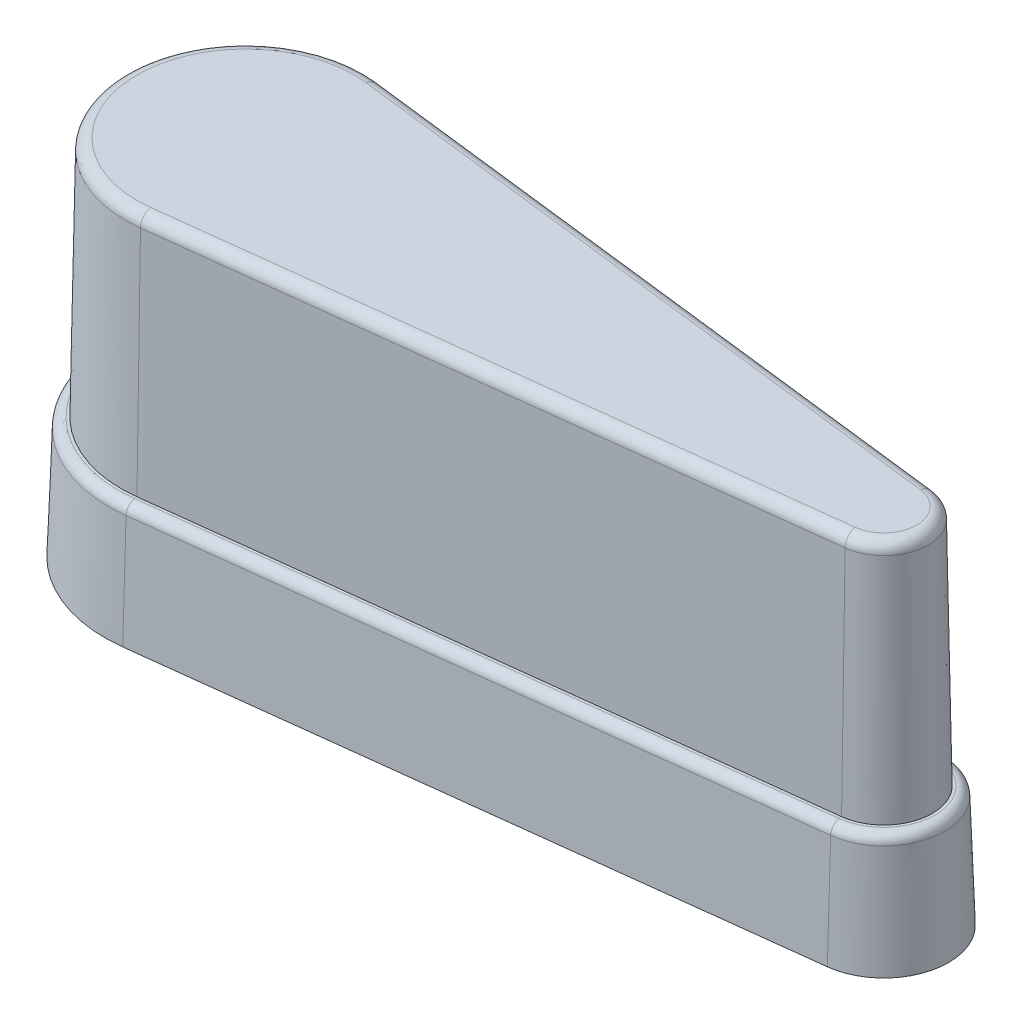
SolidWorks part; units mm, degrees
ref_plane "Front Plane" through (0, 0, 0) normal (0, 0, 1) x (1, 0, 0)
ref_plane "Top Plane" through (0, 0, 0) normal (0, 1, 0) x (1, 0, 0)
ref_plane "Right Plane" through (0, 0, 0) normal (1, 0, 0) x (0, 0, -1)
sketch "Sketch1" plane through (0, 0, 0) normal (0, 1, 0) x (1, 0, 0)
  line L0 (0, 0) -> (172.1019, 0) construction
  line L1 (0.9691, 8.0956) -> (42.262, 3.1525)
  line L2 (0.9691, -8.0956) -> (42.262, -3.1525)
  arc A0 (0.9691, 8.0956) -> (0.9691, -8.0956) centre (0, 0) ccw
  arc A1 (42.262, -3.1525) -> (42.262, 3.1525) centre (41.8846, 0) ccw
  dimension "D1" = 16.3068
  dimension "D2" = 6.35
  dimension "D3" = 53.213
extrude "Boss-Extrude1" add sketch "Sketch1" along normal blind 15.875 draft 1
sketch "Sketch2" plane through (0, 0, 0) normal (0, -1, 0) x (1, 0, 0)
  line L4 (1.0635, -8.8837) -> (42.3563, -3.9406)
  line L5 (42.3563, 3.9406) -> (1.0635, 8.8837)
  line L6 (1.0635, -8.8837) -> (42.3563, -3.9406)
  line L7 (42.3563, 3.9406) -> (1.0635, 8.8837)
  arc A4 (1.0635, 8.8837) -> (1.0635, -8.8837) centre (0, 0) ccw
  arc A5 (42.3563, -3.9406) -> (42.3563, 3.9406) centre (41.8846, 0) ccw
  arc A6 (1.0635, 8.8837) -> (1.0635, -8.8837) centre (0, 0) ccw
  arc A7 (42.3563, -3.9406) -> (42.3563, 3.9406) centre (41.8846, 0) ccw
  dimension "D1" = 0.7937
extrude "Boss-Extrude2" add sketch "Sketch2" along normal blind 7.9375 draft 2
fillet "Fillet1" radius 0.762 4 edges at (-7.8763, 15.875, 0) (21.5826, 15.875, -5.3489) (44.7825, 15.875, 0) (21.5826, 15.875, 5.3489)
fillet "Fillet2" radius 0.635 4 edges at (45.8534, 0, 0) (21.7099, 0, -6.4122) (-8.9471, 0, 0) (21.7099, 0, 6.4122)
shell "Shell1" thickness 1.905
fillet "Fillet3" radius 0.381 4 edges at (-6.2814, -1.905, 0) (21.393, -1.905, -3.7653) (43.1876, -1.905, 0) (21.393, -1.905, 3.7653)
sketch "Sketch3" plane through (0, -7.9375, 0) normal (0, -1, 0) x (1, 0, 0)
  circle A0 centre (0, 0) radius 4.953
  dimension "D1" = 9.906
extrude "Boss-Extrude3" add sketch "Sketch3" against normal up to next draft 0.5
fillet "Fillet4" radius 0.635 1 edges at (0, -7.9375, -4.953)
sketch "Sketch4" plane through (0, -7.9375, 0) normal (0, -1, 0) x (1, 0, 0)
  circle A0 centre (0, 0) radius 3.175
  dimension "D1" = 6.35
extrude "Cut-Extrude1" cut sketch "Sketch4" against normal up to surface (21.9075 mm away)
ref_plane "Plane1" through (0, -4.9213, 0) normal (0, -1, 0) x (-1, 0, 0)
sketch "Sketch5" plane through (0, -7.9375, 0) normal (0, -1, 0) x (-1, 0, 0)
  line L0 (0, 3.8729) -> (0, 8.4751)
  line L1 (0, -3.8729) -> (0, -8.4751)
  circle A0 centre (0, 0) radius 3.8729 construction
  dimension "D1" = 7.7459
  dimension "D2" = 4.6021
rib "Rib1" sketch "Sketch5" sketch "Sketch5" thickness 1.5875 extrusion direction normal to sketch draft on yes draft angle 1 parameters "D1"=1.5875, "D3"=1
sketch "Sketch6" plane through (0, -7.9375, 0) normal (0, -1, 0) x (1, 0, 0)
  line L0 (0, 0) -> (60.2846, 0) construction
  line L1 (12.2428, -7.3028) -> (12.2428, 7.3028)
  line L2 (12.2428, 0) -> (3.7656, 0)
  line L3 (20.1803, -6.35) -> (20.1803, 6.35)
  line L4 (28.1178, -5.08) -> (28.1178, 5.08)
  line L5 (36.0553, 4.064) -> (36.0553, -4.064)
  line L6 (-3.5621, 0) -> (-8.0502, 0)
  point P5 (12.2428, 0)
  point P12 (20.1803, 0)
  point P13 (28.1178, 0)
  point P16 (36.0553, 0)
  dimension "D1" = 12.2428
  dimension "D2" = 14.6055
  dimension "D3" = 7.9375
  dimension "D4" = 7.9375
  dimension "D5" = 10.16
  dimension "D6" = 12.7
  dimension "D7" = 8.128
  dimension "D8" = 7.9375
rib "Rib2" sketch "Sketch6" sketch "Sketch6" thickness 1.27 extrusion direction normal to sketch draft on no parameters "D1"=1.27
fillet "Fillet5" radius 0.635 29 edges at (4.6962, -7.7827, 0.635) (7.9422, -7.9375, 0.635) (7.9422, -7.9375, -0.635) (4.6962, -7.7827, -0.635) (0.7937, -7.9375, 5.7625) (-0.7937, -7.9375, 5.7625) (-0.7937, -7.9375, -5.7625) (0.7937, -7.9375, -5.7625) (12.8778, -7.9375, 0) (11.6078, -7.9375, -3.3079) (19.5453, -7.9375, 0) (20.8153, -7.9375, 0) (-3.7641, -6.9191, 0.635) (-5.7836, -7.9375, 0.635) (-5.7836, -7.9375, -0.635) (-3.7641, -6.9191, -0.635) (28.7528, -7.9375, 0) (27.4828, -7.9375, 0) (36.6903, -7.9375, 0) (35.4203, -7.9375, 0) (11.6078, -7.9375, 3.3079)
sketch "Sketch7" plane through (0, -7.9375, 0) normal (0, -1, 0) x (1, 0, 0)
  line L0 (46.1305, 0) -> (40.6629, 0) construction
  line L1 (44.3812, 1.5337) -> (44.3812, -1.5337)
  arc A0 (42.3893, -4.2158) -> (42.3893, 4.2158) centre (41.8846, 0) ccw construction
  arc A1 (44.3812, 1.5337) -> (44.3812, -1.5337) centre (43.9715, 0) ccw
  dimension "D1" = 3.175
  dimension "D3" = 0.4097
  dimension "D2" = 2.159
extrude "Boss-Extrude4" add sketch "Sketch7" against normal up to surface (21.9075 mm away)
